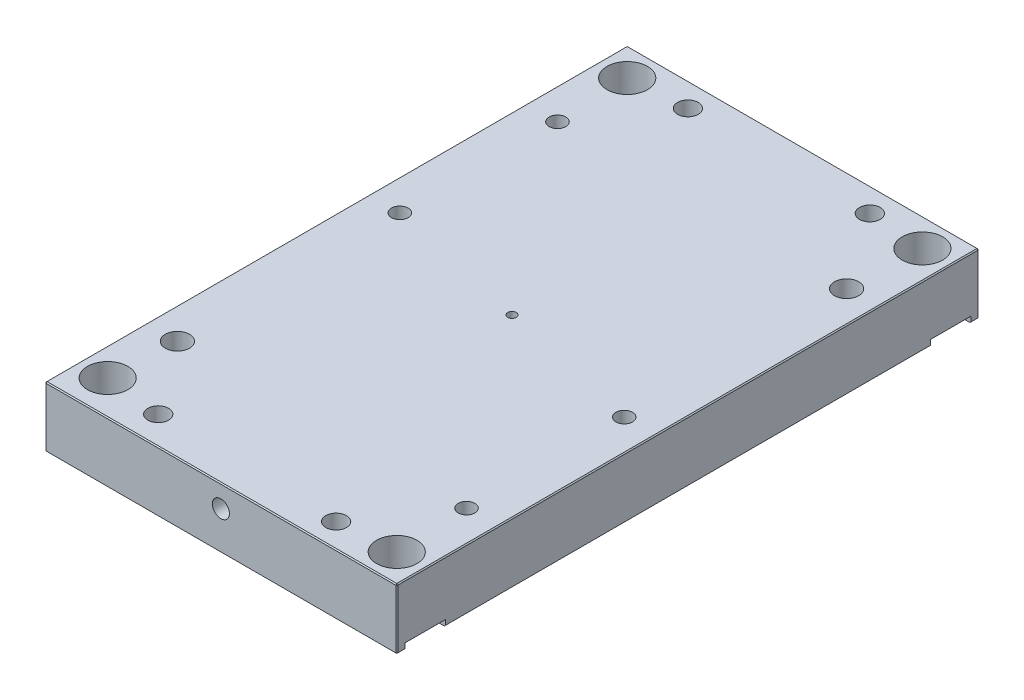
SolidWorks part; units mm, degrees
extrude "Base-Extrude" add sketch "Sketch1" along normal mid plane 457.2
sketch "Sketch1" plane through (0, 0, 0) normal (0, 0, 1) x (1, 0, 0)
  line L0 (-138.1125, 0) -> (138.1125, 0)
  line L1 (-138.1125, 0) -> (-138.1125, -47.625)
  line L2 (138.1125, -47.625) -> (-138.1125, -47.625)
  line L3 (138.1125, -47.625) -> (138.1125, 0)
  line L4 (50, 0) -> (-50, 0) construction
  dimension "halfW" = 138.1125
  dimension "W" = 276.225
  dimension "Thick" = 47.625
ref_plane "Plane1" through (0, 0, 0) normal (0, 0, 1) x (1, 0, 0)
ref_plane "Plane2" through (0, 0, 0) normal (0, 1, 0) x (1, 0, 0)
ref_plane "Plane3" through (0, 0, 0) normal (1, 0, 0) x (0, 0, -1)
other "SprueHole"
sketch "Sprue" plane through (0, 0, 0) normal (0, 1, 0) x (-1, 0, 0)
  circle A0 centre (0, 0) radius 3.3655
  dimension "SPdia" = 6.731
other "SB1"
sketch "SB1ctrl" plane through (0, 0, 0) normal (0, 1, 0) x (-1, 0, 0)
  circle A0 centre (-115.8875, -206.375) radius 15.8814
sketch "SB2ctrl" plane through (-7.7975, 0, 164.4517) normal (0, 1, 0) x (-1, 0, 0)
  circle A0 centre (-123.685, 41.9233) radius 15.8814
other "SB2"
sketch "SB3ctrl" plane through (-167.5414, 0, 167.5414) normal (0, 1, 0) x (-1, 0, 0)
  circle A0 centre (-51.6539, 34.0711) radius 15.8813
other "SB3"
sketch "SB4ctrl" plane through (-175.8091, 0, -3.5599) normal (0, 1, 0) x (-1, 0, 0)
  circle A0 centre (-59.9216, -202.8151) radius 15.8813
other "SB4"
other "RP1"
sketch "RP1ctrl" plane through (0, 0, 0) normal (0, 1, 0) x (-1, 0, 0)
  circle A0 centre (-71.4375, -209.55) radius 8.1359
sketch "RP2ctrl" plane through (-3.1102, 0, 111.0325) normal (0, 1, 0) x (-1, 0, 0)
  circle A0 centre (-74.5477, 98.5175) radius 8.1359
other "RP2"
sketch "RP3ctrl" plane through (-88.7572, 0, 117.352) normal (0, 1, 0) x (-1, 0, 0)
  circle A0 centre (-17.3197, 89.023) radius 8.1359
other "RP3"
sketch "RP4ctrl" plane through (-93.5338, 0, -10.6988) normal (0, 1, 0) x (-1, 0, 0)
  circle A0 centre (-22.0963, -198.8512) radius 8.1359
other "RP4"
other "sh1"
sketch "sh1ctrl" plane through (0, 0, 0) normal (0, 1, 0) x (-1, 0, 0)
  circle A0 centre (-113.5063, -149.225) radius 9.525
other "sh2"
sketch "sh2ctrl" plane through (0, 0, 0) normal (0, 1, 0) x (-1, 0, 0)
  circle A0 centre (-113.5062, 149.225) radius 6.5481
sketch "sh3ctrl" plane through (-168.9527, 0, 99.7718) normal (0, 1, 0) x (-1, 0, 0)
  circle A0 centre (-55.4465, 49.4532) radius 9.525
other "sh3"
sketch "sh4ctrl" plane through (-156.9372, 0, -104.1055) normal (0, 1, 0) x (-1, 0, 0)
  circle A0 centre (-43.431, -45.1195) radius 6.5481
other "sh4"
other "sh5"
sketch "sh5ctrl" plane through (0, 0, 0) normal (0, 1, 0) x (-1, 0, 0)
  circle A0 centre (-113.5063, 25.4) radius 6.5481
sketch "sh6ctrl" plane through (-173.2071, 0, -36.5888) normal (0, 1, 0) x (-1, 0, 0)
  circle A0 centre (-59.7009, 11.1888) radius 6.5481
other "sh6"
chamfer "EdgeBreak" distance 0.7937 angle 45 12 edges at (138.1125, -23.8125, 228.6) (0, 0, 228.6) (-138.1125, -23.8125, 228.6) (0, 0, -228.6) (138.1125, -23.8125, -228.6) (0, -47.625, -228.6) (-138.1125, -23.8125, -228.6) (0, -47.625, 228.6) (-138.1125, 0, 0) (138.1125, 0, 0) (138.1125, -47.625, 0) (-138.1125, -47.625, 0)
hole_wizard "5/8-11 Tapped Hole1" positions "Sketch3" profile "Sketch2" legacy
sketch "Sketch3" plane through (0, 0, 228.6) normal (0, 0, 1) x (1, 0, 0)
  line L0 (138.1125, -47.625) -> (138.1125, 0) construction
  line L1 (-138.1125, 0) -> (138.1125, 0) construction
  point P0 (0, -17.4625)
sketch "Sketch2" plane through (0, -17.4625, 228.6) normal (1, 0, 0) x (0, -1, 0)
  line L0 (0, 0) -> (0, 23.1035)
  line L1 (0, 23.1035) -> (6.7462, 19.05)
  line L2 (6.7462, 19.05) -> (6.7462, 0.0025)
  line L3 (6.7462, 0.0025) -> (6.7462, 0)
  line L5 (6.7462, 0) -> (0, 0)
  line L6 (-6.7462, 0.0025) -> (-6.7462, 0) construction
  line L10 (0, 23.1035) -> (-6.7462, 19.05) construction
  line L11 (0, -6.35) -> (0, 107.95) construction
mirror "Mirror1" about plane through (0, 0, 0) normal (0, 0, 1) of "5/8-11 Tapped Hole1"
ref_plane "Plane4" through (115.8875, 0, 0) normal (1, 0, 0) x (0, 0, -1)
sketch "Sketch4" plane through (115.8875, 0, 0) normal (1, 0, 0) x (0, 0, -1)
  line L0 (190.4936, -52.3875) -> (222.2563, -52.3875)
  line L1 (190.4936, -52.3875) -> (190.4936, -42.8625)
  line L2 (222.2563, -42.8625) -> (190.4936, -42.8625)
  line L3 (222.2563, -42.8625) -> (222.2563, -52.3875)
  line L5 (222.2563, -47.625) -> (222.2563, 0) construction
  line L6 (190.4936, 0) -> (190.4936, -47.625) construction
  line L7 (227.8063, -47.625) -> (-227.8062, -47.625) construction
  dimension "D1" = 9.525
  dimension "D2" = 4.7625
extrude "Vent" cut sketch "Sketch4" along normal through all
mirror "Mirror2" about plane through (0, 0, 0) normal (0, 0, 1) of "Vent"
mirror "Mirror3" about plane through (0, 0, 0) normal (1, 0, 0) of "Vent"
ref_plane "Plane5" through (-115.8875, 0, 0) normal (1, 0, 0) x (0, 0, -1)
sketch "Sketch5" plane through (-115.8875, 0, 0) normal (1, 0, 0) x (0, 0, -1)
  line L0 (-185.7311, -42.8625) -> (-217.4938, -42.8625)
  line L1 (-185.7311, -42.8625) -> (-185.7312, -47.625)
  line L2 (-217.4938, -47.625) -> (-185.7312, -47.625)
  line L3 (-217.4938, -47.625) -> (-217.4938, -42.8625)
  line L6 (-185.7312, -47.625) -> (-185.7312, 0) construction
  line L7 (190.4936, -47.625) -> (-190.4936, -47.625) construction
  line L8 (-217.4938, 0) -> (-217.4938, -47.625) construction
  dimension "D1" = 4.7625
extrude "Vent3" cut sketch "Sketch5" against normal through all
equation "\"D1@Sketch3\" = \"W@Sketch1\" / 2"
equation "\"D1@Plane4\" = \"SBX@SB1ctrl\""
equation "\"D1@Plane5\" = \"D1@Plane4\""
